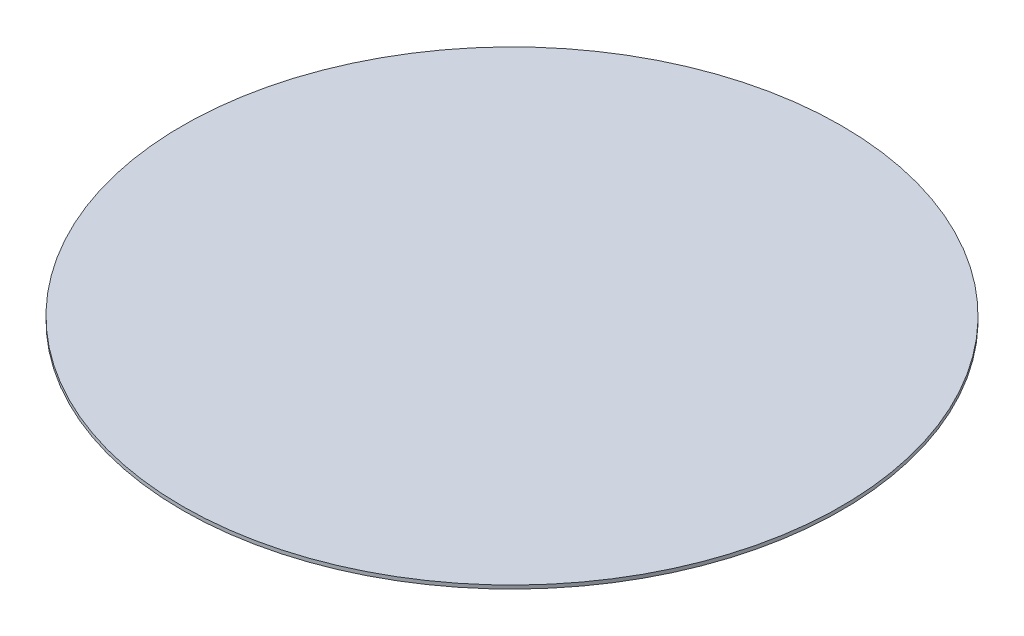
SolidWorks part; units mm, degrees
ref_plane "Front" through (0, 0, 0) normal (0, 0, 1) x (1, 0, 0)
ref_plane "Top" through (0, 0, 0) normal (0, 1, 0) x (1, 0, 0)
ref_plane "Right" through (0, 0, 0) normal (1, 0, 0) x (0, 0, -1)
sketch "Sketch2" plane through (0, 0, 0) normal (0, 1, 0) x (1, 0, 0)
  circle A0 centre (0, 0) radius 23.5
  dimension "D1" = 47
extrude "Boss-Extrude1" add sketch "Sketch2" along normal blind 0.25
